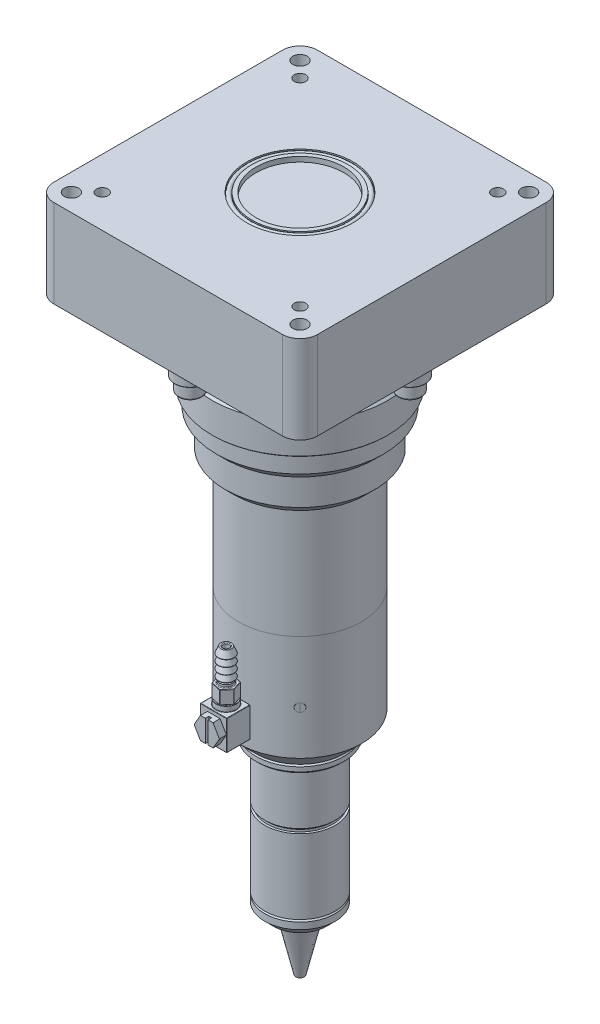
SolidWorks part; units mm, degrees
ref_plane "Front Plane" through (0, 0, 0) normal (0, 0, 1) x (1, 0, 0)
ref_plane "Top Plane" through (0, 0, 0) normal (0, 1, 0) x (1, 0, 0)
ref_plane "Right Plane" through (0, 0, 0) normal (1, 0, 0) x (0, 0, -1)
imported_body "Defeatured1"
hole_wizard "CBORE for M5 SHCS1" positions "Sketch1" profile "Sketch2" counterbore size "M5" standard "HAAS"
sketch "Sketch1" plane through (0, 0, 0) normal (0, -1, 0) x (-1, 0, 0)
  line L0 (0, 0) -> (0, 53.65) construction
  line L2 (0, 0) -> (53.1479, 0) construction
  point P0 (-41.275, -41.275)
  point P14 (-41.275, 41.275)
  point P15 (41.275, 41.275)
  point P16 (41.275, -41.275)
  dimension "D1" = 41.275
  dimension "D2" = 41.275
sketch "Sketch2" plane through (41.275, 0, 41.275) normal (1, 0, 0) x (0, 0, -1)
  line L0 (0, 0) -> (0, 31.75)
  line L1 (0, 31.75) -> (2.6035, 31.75)
  line L3 (2.6035, 31.75) -> (2.6035, 5.334)
  line L4 (2.6035, 5.334) -> (4.3561, 5.334)
  line L5 (4.3561, 5.334) -> (4.3561, 0)
  line L7 (4.3561, 0) -> (0, 0)
  line L11 (0, -6.35) -> (0, 107.95) construction
  dimension "Thru Hole Dia." = 5.207
  dimension "Thru Hole Depth" = 31.75
  dimension "C'Bore Dia." = 8.7122
  dimension "C'Bore Depth" = 5.334
